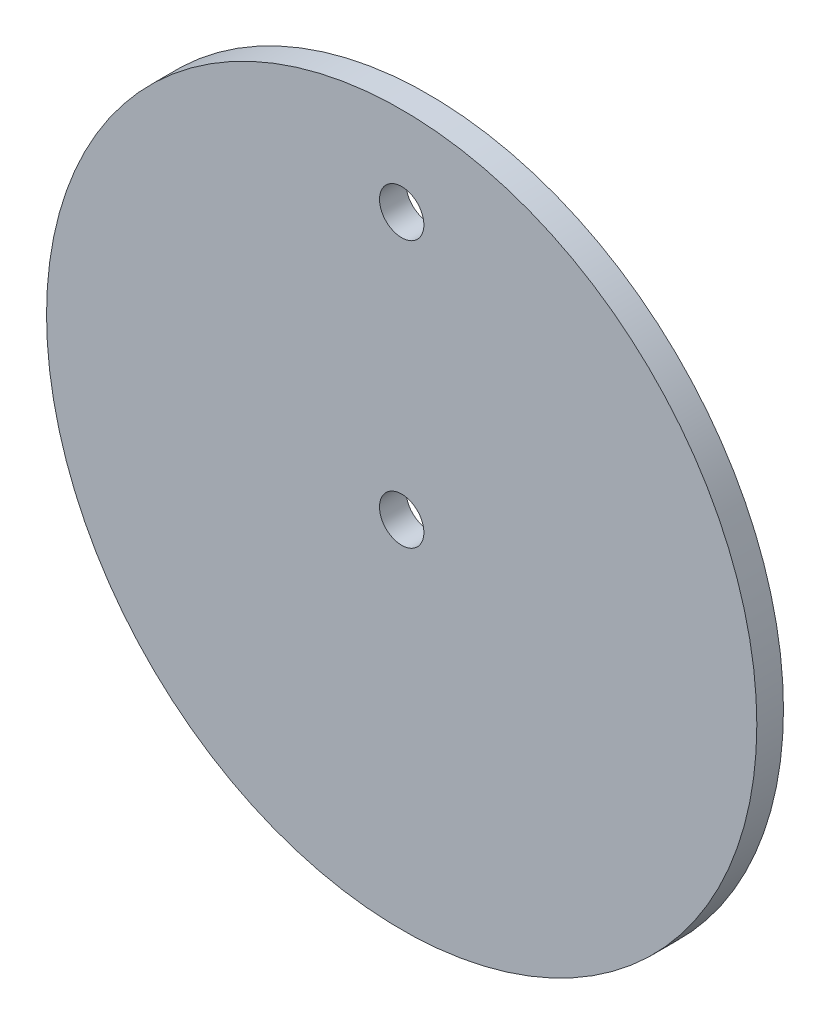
SolidWorks part; units mm, degrees
ref_plane "Plan de face" through (0, 0, 0) normal (0, 0, 1) x (1, 0, 0)
ref_plane "Plan de dessus" through (0, 0, 0) normal (0, 1, 0) x (1, 0, 0)
ref_plane "Plan de droite" through (0, 0, 0) normal (1, 0, 0) x (0, 0, -1)
sketch "Esquisse1" plane through (0, 0, 0) normal (0, 0, 1) x (1, 0, 0)
  circle A0 centre (0, 0) radius 40
  circle A1 centre (0, 0) radius 2.5
  circle A2 centre (0, 30) radius 2.5
  dimension "D1" = 80
  dimension "D2" = 5
  dimension "D3" = 5
  dimension "D4" = 30
extrude "Extrusion1" add sketch "Esquisse1" along normal blind 3
